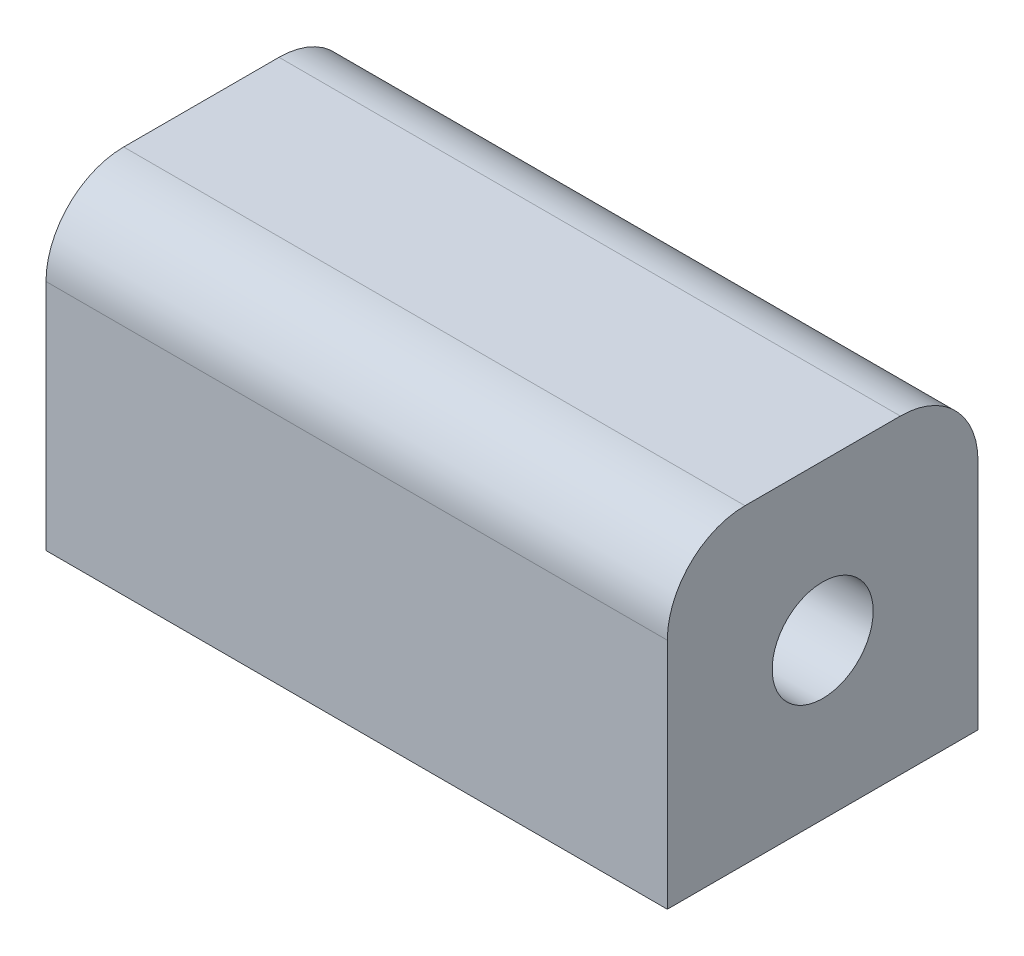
SolidWorks part; units mm, degrees
ref_plane "Front Plane" through (0, 0, 0) normal (0, 0, 1) x (1, 0, 0)
ref_plane "Top Plane" through (0, 0, 0) normal (0, 1, 0) x (1, 0, 0)
ref_plane "Right Plane" through (0, 0, 0) normal (1, 0, 0) x (0, 0, -1)
sketch "Sketch1" plane through (0, 0, 0) normal (0, 1, 0) x (1, 0, 0)
  line L1 (0, 0) -> (40, 0)
  line L2 (0, 0) -> (0, 20)
  line L3 (0, 20) -> (40, 20)
  line L4 (40, 0) -> (40, 20)
  dimension "D1" = 40
  dimension "D2" = 20
extrude "Extrude1" add sketch "Sketch1" along normal blind 20
sketch "Sketch2" plane through (40, 0, 0) normal (1, 0, 0) x (0, 0, -1)
  line L0 (20, 20) -> (0, 0) construction
  circle A0 centre (10, 10) radius 3.25
  dimension "D1" = 6.5
extrude "Extrude2" cut sketch "Sketch2" against normal through all
sketch "Sketch3" plane through (0, 0, 0) normal (0, -1, 0) x (1, 0, 0)
  line L0 (40, -10) -> (0, -10) construction
  line L1 (40, 0) -> (40, -20) construction
  line L2 (0, -20) -> (0, 0) construction
  circle A0 centre (30, -10) radius 1.5
  circle A1 centre (10, -10) radius 1.5
  dimension "D1" = 3
  dimension "D2" = 10
  dimension "D3" = 10
extrude "Extrude3" cut sketch "Sketch3" against normal blind 10
fillet "Fillet1" radius 5 2 edges at (20, 20, -20) (20, 20, 0)
